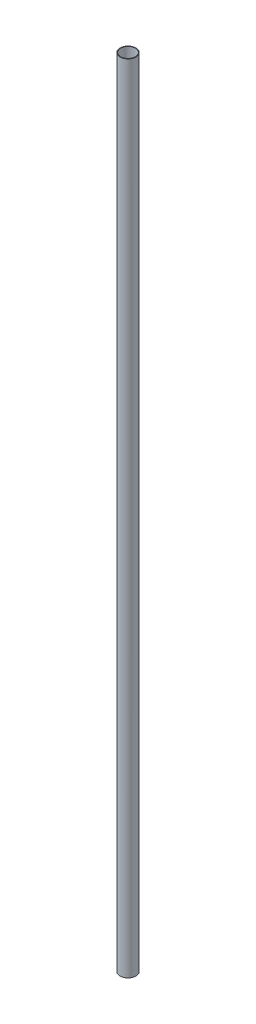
SolidWorks part; units mm, degrees
ref_plane "Face" through (0, 0, 0) normal (0, 0, 1) x (1, 0, 0)
ref_plane "Dessus" through (0, 0, 0) normal (0, 1, 0) x (1, 0, 0)
ref_plane "Droite" through (0, 0, 0) normal (1, 0, 0) x (0, 0, -1)
sketch "Esquisse1" plane through (0, 0, 0) normal (0, 1, 0) x (1, 0, 0)
  circle A0 centre (0, 0) radius 30
  circle A1 centre (0, 0) radius 28
  dimension "D1" = 60
  dimension "D2" = 56
extrude "Base-Extrusion" add sketch "Esquisse1" along normal blind 3000 and the other way blind 23
sketch "Esquisse2" plane through (0, 0, 0) normal (1, 0, 0) x (0, 0, -1)
  line L0 (-23, -30) -> (-23, 5)
  line L1 (-23, -30) -> (23, -30)
  line L2 (23, -30) -> (23, 5)
  arc A0 (-23, 5) -> (23, 5) centre (0, 5) cw
  dimension "D1" = 23
  dimension "D2" = 5
  dimension "D3" = 46
extrude "Enlèv. mat.-Extru.1" cut sketch "Esquisse2" against normal through all
sketch "Esquisse3" plane through (0, 0, 0) normal (1, 0, 0) x (0, 0, -1)
  line L0 (0, 3000) -> (0, -23) construction
  circle A0 centre (0, 47.5) radius 5
  circle A1 centre (0, 107.5) radius 5
  dimension "D2" = 10
  dimension "D3" = 10
  dimension "D1" = 60
  dimension "D4" = 107.5
extrude "Enlèv. mat.-Extru.4" cut sketch "Esquisse3" against normal through all
